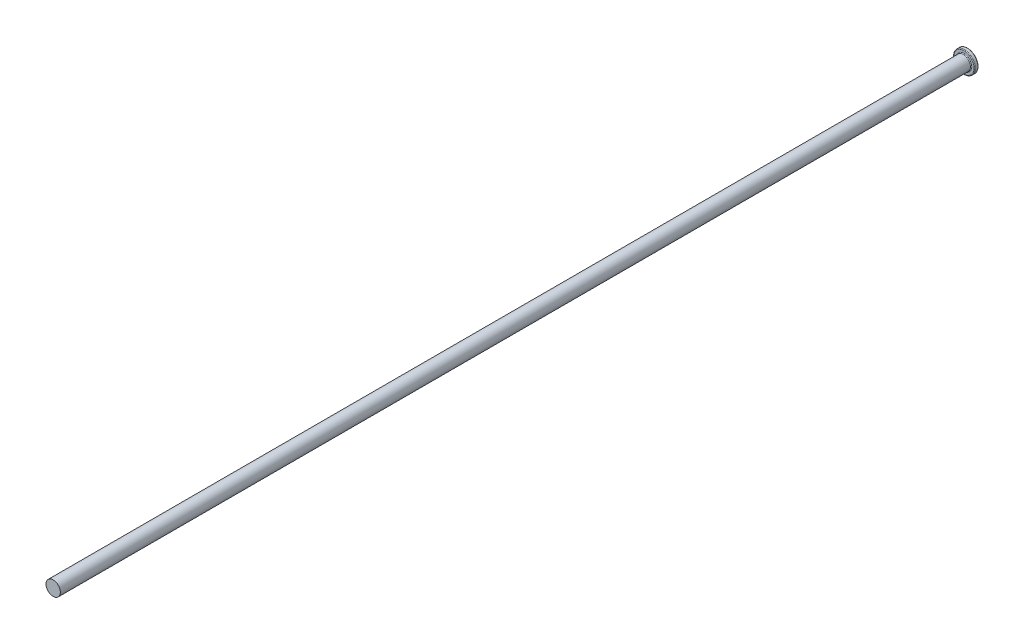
SolidWorks part; units mm, degrees
ref_plane "Front Plane" through (0, 0, 0) normal (0, 0, 1) x (1, 0, 0)
ref_plane "Top Plane" through (0, 0, 0) normal (0, 1, 0) x (1, 0, 0)
ref_plane "Right Plane" through (0, 0, 0) normal (1, 0, 0) x (0, 0, -1)
sketch "Sketch1" plane through (0, 0, 0) normal (0, 0, 1) x (1, 0, 0)
  circle A1 centre (0, 0) radius 1
  dimension "D2" = 2
extrude "Boss-Extrude2" add sketch "Sketch1" along normal blind 127
sketch "Sketch2" plane through (0, 0, 0) normal (0, 0, -1) x (-1, 0, 0)
  circle A0 centre (0, 0) radius 1.5
  dimension "D1" = 3
extrude "Boss-Extrude3" add sketch "Sketch2" along normal blind 0.5
fillet "Fillet1" radius 0.1 1 edges at (1, 0, 0)
fillet "Fillet4" radius 0.1 1 edges at (-1.5, 0, 0)
fillet "Fillet5" radius 0.05 1 edges at (-1.5, 0, -0.5)
